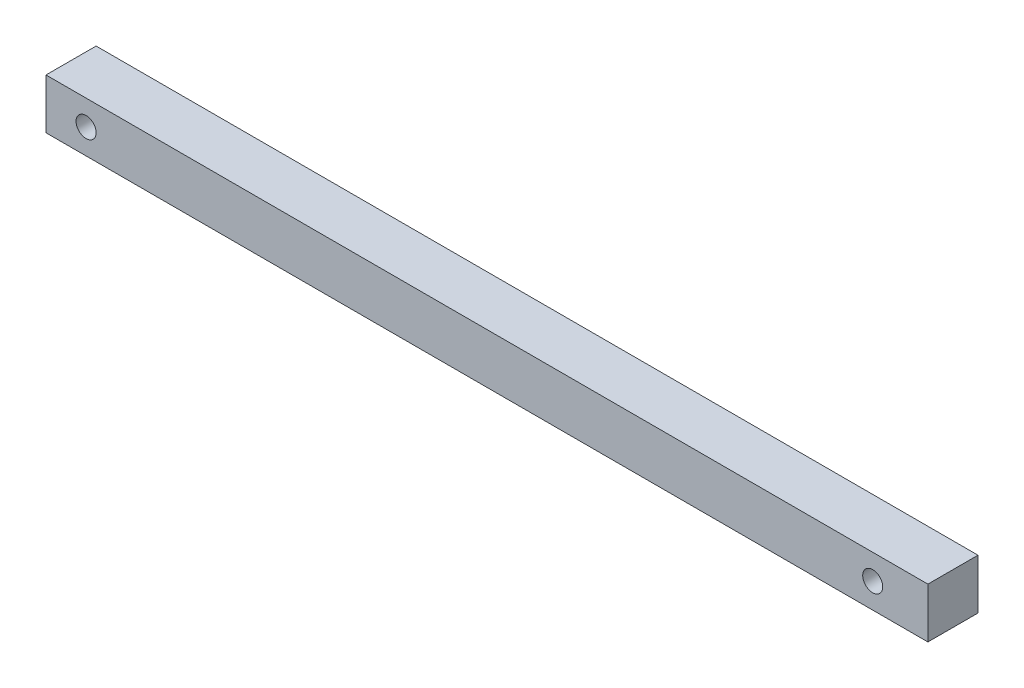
SolidWorks part; units mm, degrees
ref_plane "Front Plane" through (0, 0, 0) normal (0, 0, 1) x (1, 0, 0)
ref_plane "Top Plane" through (0, 0, 0) normal (0, 1, 0) x (1, 0, 0)
ref_plane "Right Plane" through (0, 0, 0) normal (1, 0, 0) x (0, 0, -1)
sketch "Sketch1" plane through (0, 0, 0) normal (0, 0, 1) x (1, 0, 0)
  line L1 (-50, 2.5) -> (38, 2.5)
  line L2 (-50, 2.5) -> (-50, -2.5)
  line L3 (-50, -2.5) -> (38, -2.5)
  line L4 (38, 2.5) -> (38, -2.5)
extrude "Boss-Extrude1" add sketch "Sketch1" along normal blind 5
sketch "Sketch2" plane through (0, 0, 5) normal (0, 0, 1) x (1, 0, 0)
  line L0 (-50, 2.5) -> (-50, -2.5) construction
  circle A0 centre (-46, 0) radius 1
  circle A1 centre (32.4948, 0) radius 1
  dimension "D1" = 78.4948
  dimension "D2" = 4
extrude "Cut-Extrude1" cut sketch "Sketch2" against normal blind 5
